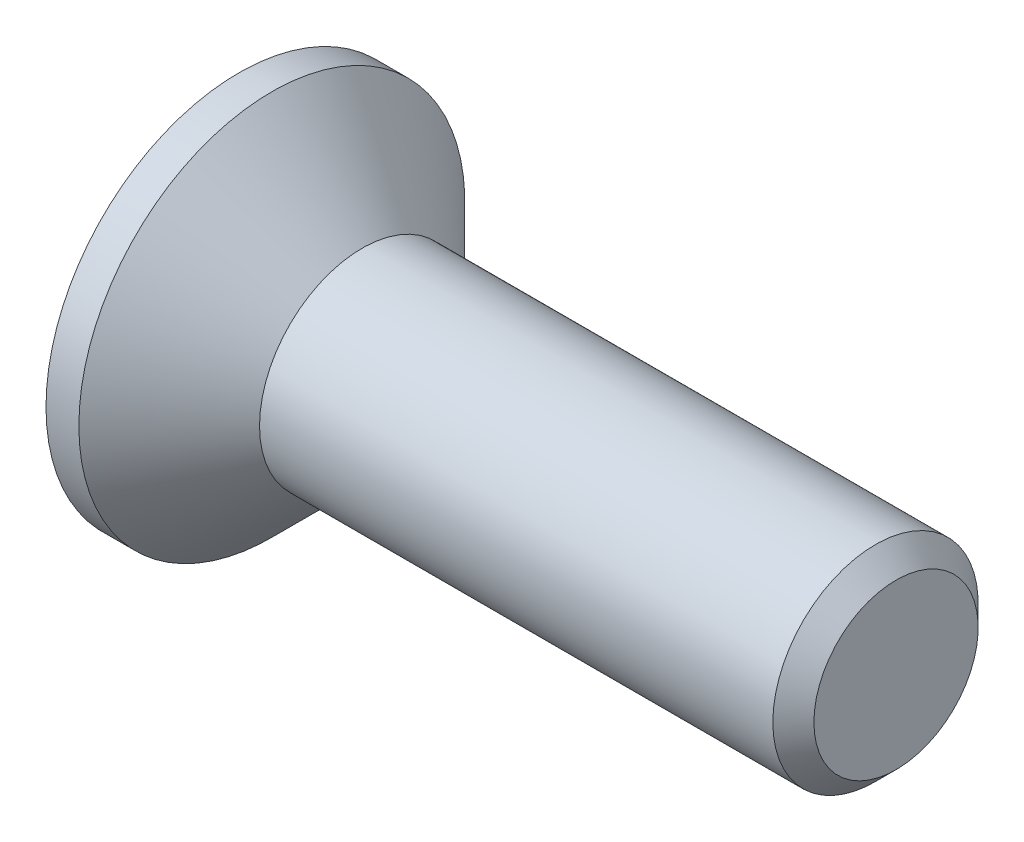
SolidWorks part; units mm, degrees
ref_plane "Front Plane" through (0, 0, 0) normal (0, 0, 1) x (1, 0, 0)
ref_plane "Top Plane" through (0, 0, 0) normal (0, 1, 0) x (1, 0, 0)
ref_plane "Right Plane" through (0, 0, 0) normal (1, 0, 0) x (0, 0, -1)
sketch "Sketch1" plane through (0, 0, 0) normal (0, 0, 1) x (1, 0, 0)
  line L1 (-1.5, 2.35) -> (-1.5, 0)
  line L2 (-1.5, 0) -> (6.5, 0)
  line L3 (6.5, 0) -> (6.5, 1.25)
  line L4 (6.5, 1.25) -> (0, 1.25)
  line L5 (-1.5, 2.35) -> (-1.1, 2.35)
  line L6 (-1.1, 2.35) -> (0, 1.25)
  dimension "D1" = 1.25
  dimension "D2" = 45
  dimension "D3" = 1.5
  dimension "D4" = 8
  dimension "D5" = 2.35
revolve "Revolve1" add sketch "Sketch1" angle 360 about L2
chamfer "Chamfer1" distance 0.25 angle 45 1 edges at (6.5, 0, 1.25)
sketch "Sketch2" plane through (-1.5, 0, 0) normal (-1, 0, 0) x (0, 0, 1)
  line L0 (-0.34, 1.35) -> (0.34, 1.35)
  line L1 (0.34, 1.35) -> (0.34, 0.34)
  line L2 (0.34, 0.34) -> (1.35, 0.34)
  line L3 (1.35, 0.34) -> (1.35, -0.34)
  line L4 (1.35, -0.34) -> (0.34, -0.34)
  line L5 (0.34, -0.34) -> (0.34, -1.35)
  line L6 (0.34, -1.35) -> (-0.34, -1.35)
  line L7 (-0.34, -1.35) -> (-0.34, -0.34)
  line L8 (-0.34, -0.34) -> (-1.35, -0.34)
  line L9 (-1.35, -0.34) -> (-1.35, 0.34)
  line L10 (-1.35, 0.34) -> (-0.34, 0.34)
  line L11 (-0.34, 0.34) -> (-0.34, 1.35)
  point P2 (0, 1.35)
  point P14 (0, -1.35)
  point P15 (1.35, 0)
  point P16 (-1.35, 0)
  dimension "D1" = 2.7
  dimension "D2" = 0.68
extrude "Cut-Extrude1" cut sketch "Sketch2" against normal blind 1.25
